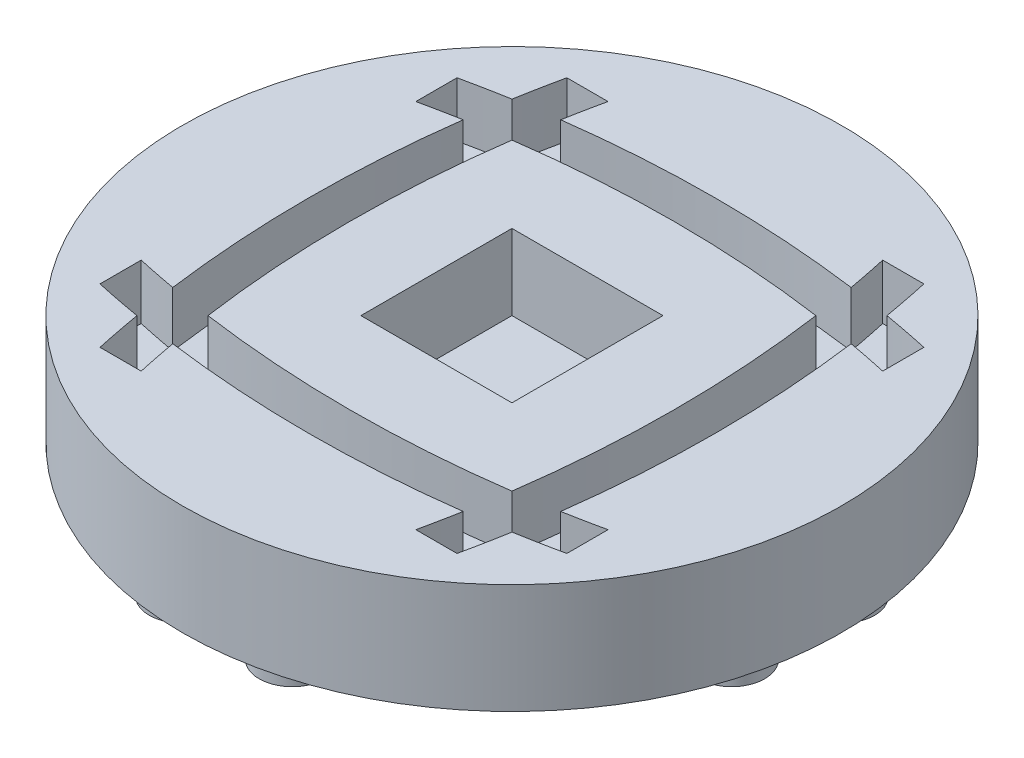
SolidWorks part; units mm, degrees
ref_plane "Front Plane" through (0, 0, 0) normal (0, 0, 1) x (1, 0, 0)
ref_plane "Top Plane" through (0, 0, 0) normal (0, 1, 0) x (1, 0, 0)
ref_plane "Right Plane" through (0, 0, 0) normal (1, 0, 0) x (0, 0, -1)
sketch "Sketch1" plane through (0, 0, 0) normal (0, 1, 0) x (1, 0, 0)
  circle A0 centre (0, 0) radius 24
  dimension "D1" = 48
extrude "Boss-Extrude1" add sketch "Sketch1" along normal blind 8
sketch "Sketch3" plane through (0, 8, 0) normal (0, 1, 0) x (1, 0, 0)
  line L0 (-5.5, 5.5) -> (5.5, 5.5)
  line L1 (5.5, 5.5) -> (5.5, -5.5)
  line L2 (5.5, -5.5) -> (-5.5, -5.5)
  line L3 (-5.5, -5.5) -> (-5.5, 5.5)
  dimension "D1" = 11
  dimension "D2" = 5.5
  dimension "D3" = 11
  dimension "D4" = 5.5
extrude "Cut-Extrude2" cut sketch "Sketch3" against normal blind 5.5
sketch "Sketch10" plane through (0, 8, 0) normal (0, 1, 0) x (1, 0, 0)
  line L1 (-17, 13) -> (-17, 10)
  line L3 (17, 10) -> (17, 13)
  line L4 (10, -17) -> (13, -17)
  line L5 (13, 17) -> (10, 17)
  line L7 (-17, -10) -> (-17, -13)
  line L8 (17, -13) -> (17, -10)
  line L10 (-10, 17) -> (-13, 17)
  line L11 (-13, -17) -> (-10, -17)
  arc A0 (-17, 13) -> (-13.6534, 13.6534) centre (0, -65.1729) cw
  arc A1 (-17, 10) -> (-14.125, 10.5759) centre (0, -67.4053) cw
  arc A2 (10, 17) -> (10.5759, 14.125) centre (-67.4053, 0) cw
  arc A3 (13, 17) -> (13.6534, 13.6534) centre (-65.1729, 0) cw
  arc A4 (17, -10) -> (14.125, -10.5759) centre (0, 67.4053) cw
  arc A5 (17, -13) -> (13.6534, -13.6534) centre (0, 65.1729) cw
  arc A6 (-10, -17) -> (-10.5759, -14.125) centre (67.4053, 0) cw
  arc A7 (-13, -17) -> (-13.6534, -13.6534) centre (65.1729, 0) cw
  arc A8 (-10.5759, 14.125) -> (-10, 17) centre (67.4053, 0) cw
  arc A9 (-13.6534, 13.6534) -> (-13, 17) centre (65.1729, 0) cw
  arc A10 (-11.0681, 11.0681) -> (11.0681, 11.0681) centre (0, -67.4053) cw
  arc A11 (-10.5759, 14.125) -> (10.5759, 14.125) centre (0, -65.1729) cw
  arc A12 (13.6534, 13.6534) -> (17, 13) centre (0, -65.1729) cw
  arc A13 (14.125, 10.5759) -> (17, 10) centre (0, -67.4053) cw
  arc A14 (11.0681, 11.0681) -> (11.0681, -11.0681) centre (-67.4053, 0) cw
  arc A15 (14.125, 10.5759) -> (14.125, -10.5759) centre (-65.1729, 0) cw
  arc A16 (13.6534, -13.6534) -> (13, -17) centre (-65.1729, 0) cw
  arc A17 (10.5759, -14.125) -> (10, -17) centre (-67.4053, 0) cw
  arc A18 (11.0681, -11.0681) -> (-11.0681, -11.0681) centre (0, 67.4053) cw
  arc A19 (10.5759, -14.125) -> (-10.5759, -14.125) centre (0, 65.1729) cw
  arc A20 (-13.6534, -13.6534) -> (-17, -13) centre (0, 65.1729) cw
  arc A21 (-14.125, -10.5759) -> (-14.125, 10.5759) centre (65.1729, 0) cw
  arc A22 (-14.125, -10.5759) -> (-17, -10) centre (0, 67.4053) cw
  arc A23 (-11.0681, -11.0681) -> (-11.0681, 11.0681) centre (67.4053, 0) cw
  point P36 (0, 0)
extrude "Cut-Extrude6" cut sketch "Sketch10" against normal blind 4
sketch "Sketch11" plane through (0, 0, 0) normal (0, -1, 0) x (1, 0, 0)
  circle A3 centre (-4, -20) radius 2.41
  circle A4 centre (4, -20) radius 2.41
  circle A9 centre (-12, -12) radius 2.41
  circle A10 centre (-4, -12) radius 2.41
  circle A11 centre (4, -12) radius 2.41
  circle A12 centre (12, -12) radius 2.41
  circle A16 centre (-12, -4) radius 2.41
  circle A17 centre (-4, -4) radius 2.41
  circle A18 centre (4, -4) radius 2.41
  circle A19 centre (12, -4) radius 2.41
  circle A20 centre (20, -4) radius 2.41
  circle A23 centre (-12, 4) radius 2.41
  circle A24 centre (-4, 4) radius 2.41
  circle A25 centre (4, 4) radius 2.41
  circle A26 centre (12, 4) radius 2.41
  circle A27 centre (20, 4) radius 2.41
  circle A30 centre (-12, 12) radius 2.41
  circle A31 centre (-4, 12) radius 2.41
  circle A32 centre (4, 12) radius 2.41
  circle A33 centre (12, 12) radius 2.41
  circle A38 centre (-4, 20) radius 2.41
  circle A39 centre (4, 20) radius 2.41
  circle A59 centre (-20, -4) radius 2.41
  circle A60 centre (-20, 4) radius 2.41
extrude "Boss-Extrude2" add sketch "Sketch11" along normal blind 1.7
equation "\"D2@Sketch10\"=\"D1@Sketch10\"/2"
equation "\"D3@Sketch11\"=\"D11@Sketch11\""
equation "\"D4@Sketch11\"=\"D11@Sketch11\""
equation "\"D5@Sketch11\"=\"D11@Sketch11\""
equation "\"D6@Sketch11\"=\"D11@Sketch11\""
equation "\"D1@Sketch11\"=\"D11@Sketch11\""
equation "\"D2@Sketch11\"=\"D11@Sketch11\""
equation "\"D14@Sketch11\"=\"D11@Sketch11\""
equation "\"D21@Sketch11\"=\"D11@Sketch11\""
equation "\"D22@Sketch11\"=\"D11@Sketch11\""
equation "\"D23@Sketch11\"=\"D11@Sketch11\""
equation "\"D24@Sketch11\"=\"D11@Sketch11\""
equation "\"D7@Sketch11\"=\"D11@Sketch11\""
equation "\"D8@Sketch11\"=\"D11@Sketch11\""
equation "\"D17@Sketch11\"=\"D11@Sketch11\""
equation "\"D18@Sketch11\"=\"D11@Sketch11\""
equation "\"D19@Sketch11\"=\"D11@Sketch11\""
equation "\"D20@Sketch11\"=\"D11@Sketch11\""
equation "\"D13@Sketch11\"=\"D11@Sketch11\""
equation "\"D12@Sketch11\"=\"D11@Sketch11\""
equation "\"D15@Sketch11\"=\"D11@Sketch11\""
equation "\"D16@Sketch11\"=\"D11@Sketch11\""
equation "\"D9@Sketch11\"=\"D11@Sketch11\""
equation "\"D10@Sketch11\"=\"D11@Sketch11\""
